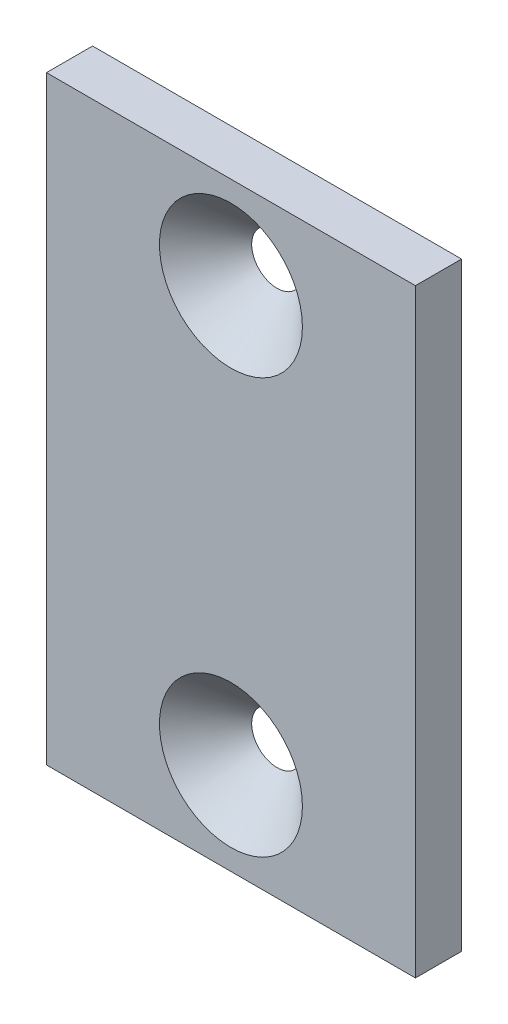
SolidWorks part; units mm, degrees
ref_plane "Front Plane" through (0, 0, 0) normal (0, 0, 1) x (1, 0, 0)
ref_plane "Top Plane" through (0, 0, 0) normal (0, 1, 0) x (1, 0, 0)
ref_plane "Right Plane" through (0, 0, 0) normal (1, 0, 0) x (0, 0, -1)
sketch "Sketch1" plane through (0, 0, 0) normal (0, 0, 1) x (1, 0, 0)
  line L0 (-20, 65) -> (-20, 0) construction
  line L1 (0, 0) -> (-40, 0)
  line L2 (0, 0) -> (0, 65)
  line L3 (0, 65) -> (-40, 65)
  line L4 (-40, 0) -> (-40, 65)
  circle A0 centre (-20, 55) radius 2.75
  circle A1 centre (-20, 10) radius 2.75
  dimension "D3" = 5.5
  dimension "D4" = 5.5
  dimension "D1" = 40
  dimension "D2" = 65
  dimension "D5" = 10
  dimension "D6" = 10
extrude "Boss-Extrude1" add sketch "Sketch1" along normal blind 5
chamfer "Chamfer1" distance 5 angle 45 2 edges at (-17.25, 10, 5) (-17.25, 55, 5)
ref_plane "Mid-plane" through (-20, 0, 0) normal (1, 0, 0) x (0, 0, -1)
